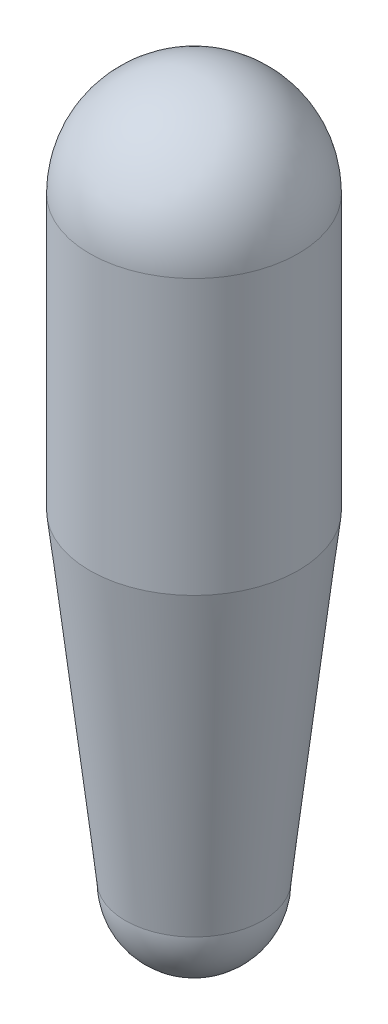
SolidWorks part; units mm, degrees
ref_plane "Front Plane" through (0, 0, 0) normal (0, 0, 1) x (1, 0, 0)
ref_plane "Top Plane" through (0, 0, 0) normal (0, 1, 0) x (1, 0, 0)
ref_plane "Right Plane" through (0, 0, 0) normal (1, 0, 0) x (0, 0, -1)
sketch "Sketch1" plane through (0, 0, 0) normal (0, 0, 1) x (1, 0, 0)
  line L0 (-48.26, 0) -> (48.26, 0)
  arc A0 (48.26, 0) -> (-48.26, 0) centre (0, 0) ccw
  dimension "D1" = 96.52
revolve "Revolve1" add sketch "Sketch1" angle 360 about L0
sketch "Sketch2" plane through (0, 0, 0) normal (0, 0, 1) x (1, 0, 0)
  line L0 (-31.75, -275.59) -> (31.75, -275.59)
  arc A0 (-31.75, -275.59) -> (31.75, -275.59) centre (0, -275.59) ccw
  arc A1 (48.26, 0) -> (-48.26, 0) centre (0, 0) ccw construction
  dimension "D1" = 63.5
  dimension "D2" = 355.6
revolve "Revolve2" add sketch "Sketch2" angle 360 about L0
sketch "Sketch3" plane through (0, 0, 0) normal (1, 0, 0) x (0, 0, -1)
  line L0 (0, 0) -> (0, -275.59)
  line L1 (0, -275.59) -> (31.75, -275.59)
  line L2 (31.75, -275.59) -> (48.26, 0) construction
  line L3 (48.26, 0) -> (0, 0)
  line L4 (48.26, 0) -> (48.26, -127)
  line L5 (48.26, -127) -> (31.75, -275.59)
  circle A0 centre (0, 0) radius 48.26 construction
  circle A1 centre (0, -275.59) radius 31.75 construction
  dimension "D2" = 127
revolve "Revolve3" add sketch "Sketch3" angle 360 about L0
